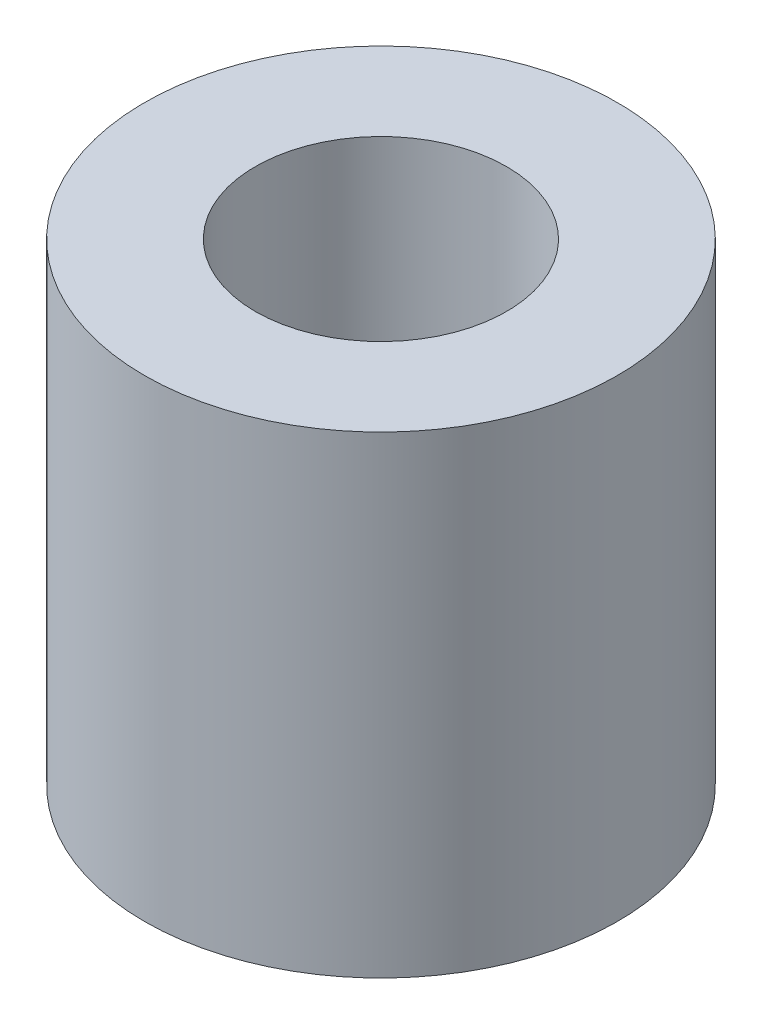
SolidWorks part; units mm, degrees
ref_plane "Plan de face" through (0, 0, 0) normal (0, 0, 1) x (1, 0, 0)
ref_plane "Plan de dessus" through (0, 0, 0) normal (0, 1, 0) x (1, 0, 0)
ref_plane "Plan de droite" through (0, 0, 0) normal (1, 0, 0) x (0, 0, -1)
sketch "Esquisse1" plane through (0, 0, 0) normal (0, 1, 0) x (1, 0, 0)
  circle A0 centre (0, 0) radius 2.125
  circle A1 centre (0, 0) radius 4
  dimension "D1" = 4.25
  dimension "D2" = 8
extrude "Boss.-Extru.1" add sketch "Esquisse1" along normal mid plane 8
